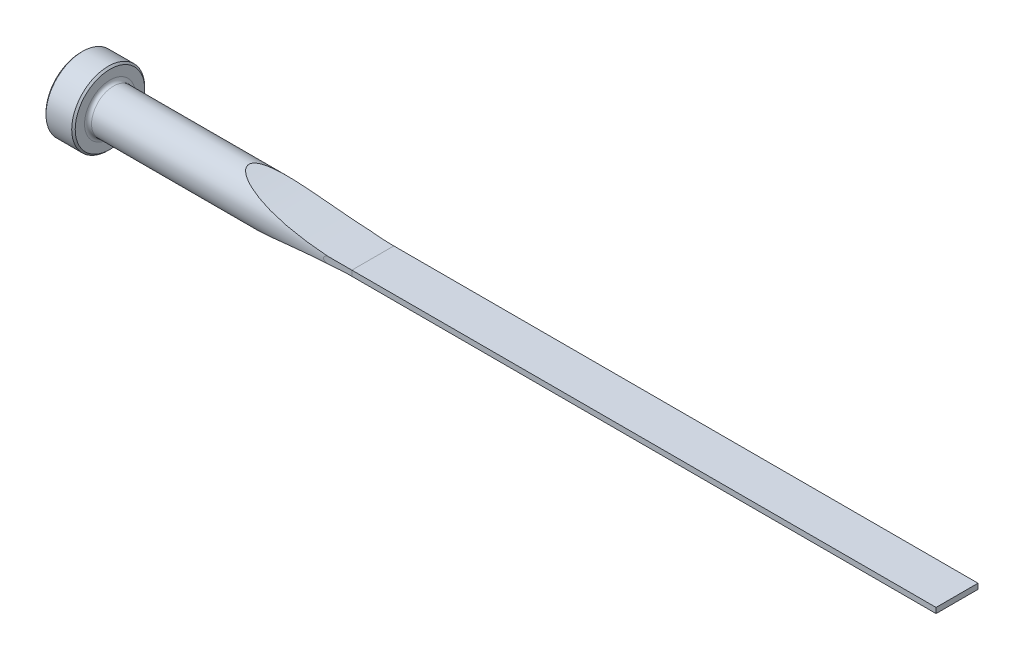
SolidWorks part; units mm, degrees
ref_plane "Front Plane" through (0, 0, 0) normal (0, 0, 1) x (1, 0, 0)
ref_plane "Top Plane" through (0, 0, 0) normal (0, 1, 0) x (1, 0, 0)
ref_plane "Right Plane" through (0, 0, 0) normal (1, 0, 0) x (0, 0, -1)
sketch "Sketch1" plane through (0, 0, 0) normal (0, 0, 1) x (1, 0, 0)
  line L0 (0, 0) -> (175.5286, 0) construction
  line L1 (0, 0) -> (0, 7.9375)
  line L2 (0, 7.9375) -> (6.35, 7.9375)
  line L3 (6.35, 7.9375) -> (6.35, 4.7625)
  line L4 (6.35, 4.7625) -> (190.5, 4.7625)
  line L5 (190.5, 4.7625) -> (190.5, 0)
  line L6 (190.5, 0) -> (0, 0)
  dimension "D1" = 190.5
  dimension "D2" = 15.875
  dimension "D3" = 9.525
  dimension "D4" = 6.35
revolve "Revolve1" add sketch "Sketch1" angle 360 about L0
sketch "Sketch2" plane through (0, 0, 0) normal (0, 0, 1) x (1, 0, 0)
  line L0 (190.5, 4.7625) -> (190.5, 0.5842)
  line L1 (190.5, -4.7625) -> (190.5, 4.7625) construction
  line L2 (190.5, 0.5842) -> (63.5, 0.5842)
  line L3 (190.5, 4.7625) -> (6.35, 4.7625) construction
  line L4 (36.5659, 4.7625) -> (190.5, 4.7625)
  line L5 (166.0833, 0) -> (153.1705, 0) construction
  arc A0 (63.5, 0.5842) -> (36.5659, 4.7625) centre (63.5, 89.4842) cw
  dimension "D1" = 88.9
  dimension "D3" = 127
  dimension "D2" = 1.1684
  dimension "D4" = 26.9341
extrude "Cut-Extrude1" cut sketch "Sketch2" against normal through all both and the other way through all
mirror "Mirror1" about plane through (0, 0, 0) normal (0, 1, 0) of "Cut-Extrude1"
sketch "Sketch3" plane through (0, 0, 0) normal (0, 1, 0) x (1, 0, 0)
  line L0 (190.5, 4.7625) -> (190.5, 4.5593)
  line L1 (190.5, 4.7265) -> (190.5, -4.7265) construction
  line L2 (190.5, 4.5593) -> (63.5, 4.5593)
  line L3 (190.5, 4.7625) -> (6.35, 4.7625) construction
  line L4 (57.4927, 4.7625) -> (190.5, 4.7625)
  line L5 (163.4716, 0) -> (166.2513, 0) construction
  line L6 (63.5, 4.7265) -> (63.5, -4.7265) construction
  arc A0 (63.5, 4.5593) -> (57.4927, 4.7625) centre (63.5, 93.4593) cw
  dimension "D2" = 88.9
  dimension "D1" = 9.1186
extrude "Cut-Extrude2" cut sketch "Sketch3" against normal through all both and the other way through all
mirror "Mirror2" about plane through (0, 0, 0) normal (0, 0, 1) of "Cut-Extrude2"
fillet "Fillet1" radius 0.762 1 edges at (6.35, 0, 4.7625)
chamfer "Chamfer1" distance 0.381 angle 45 2 edges at (0, 0, 7.9375) (6.35, 0, 7.9375)
